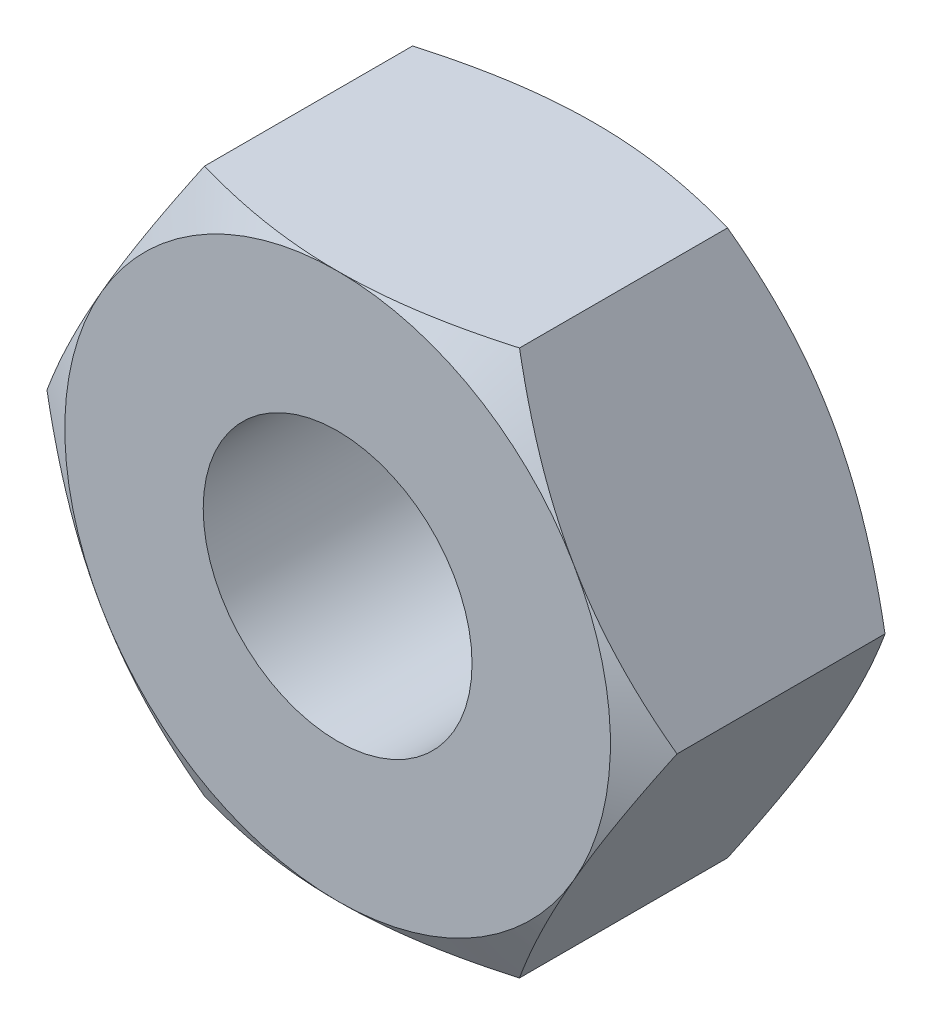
SolidWorks part; units mm, degrees
ref_plane "Plan de face" through (0, 0, 0) normal (0, 0, 1) x (1, 0, 0)
ref_plane "Plan de dessus" through (0, 0, 0) normal (0, 1, 0) x (1, 0, 0)
ref_plane "Plan de droite" through (0, 0, 0) normal (1, 0, 0) x (0, 0, -1)
imported_body "Importée3"
hole_wizard "Perçage1" positions "Esquisse2" profile "Esquisse1" legacy
sketch "Esquisse2" plane through (0, 0, 0) normal (0, 0, 1) x (1, 0, 0)
  point P0 (0, 0)
sketch "Esquisse1" plane through (0, 0, 0) normal (1, 0, 0) x (0, -1, 0)
  line L0 (0, 0) -> (0, 8)
  line L1 (0, 8) -> (4.1881, 8)
  line L2 (4.1881, 8) -> (4.1881, 0)
  line L3 (4.1881, 0) -> (0, 0)
  line L4 (0, 110) -> (0, -10) construction
  dimension "Diamètre" = 8.3763
  dimension "Profondeur" = 8
